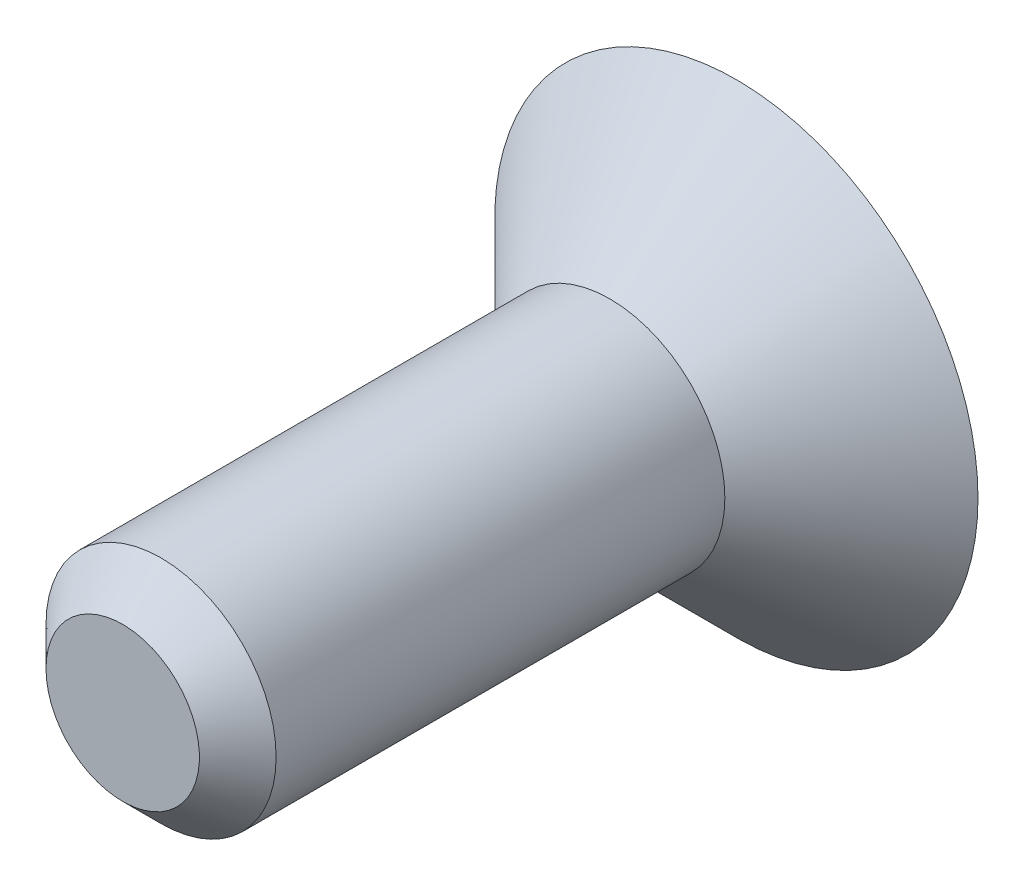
SolidWorks part; units mm, degrees
ref_plane "Plan1" through (0, 0, 0) normal (0, 0, 1) x (1, 0, 0)
ref_plane "Plan2" through (0, 0, 0) normal (0, 1, 0) x (1, 0, 0)
ref_plane "Plan3" through (0, 0, 0) normal (1, 0, 0) x (0, 0, -1)
sketch "Esquisse1" plane through (0, 0, 0) normal (0, 0, 1) x (1, 0, 0)
  circle A0 centre (0, 0) radius 3.15
  dimension "D1" = 6.3
extrude "Tête" add sketch "Esquisse1" along normal blind 2 draft 45
sketch "Esquisse2" plane through (0, 0, 0) normal (0, 0, -1) x (-1, 0, 0)
  circle A0 centre (0, 0) radius 1.5
  dimension "D1" = 3
extrude "Corps" add sketch "Esquisse2" against normal blind 8
sketch "Esquisse3" plane through (0, 0, 0) normal (0, 0, 1) x (1, 0, 0)
  line L0 (0, 0) -> (1.575, 0) construction
  line L1 (-1.575, 0.4) -> (1.575, 0.4)
  line L2 (-1.575, 0.4) -> (-1.575, -0.4)
  line L3 (-1.575, -0.4) -> (1.575, -0.4)
  line L4 (1.575, 0.4) -> (1.575, -0.4)
  line L5 (1.575, 0) -> (3.15, 0) construction
  line L6 (-1.575, 0) -> (-3.15, 0) construction
  circle A0 centre (0, 0) radius 3.15 construction
  dimension "D1" = 0.8
extrude "Empreinte" cut sketch "Esquisse3" along normal blind 0.8
pattern_circular "Répétition circulaire1" count 2 every 90
chamfer "Chanfrein" distance 0.5 angle 45
